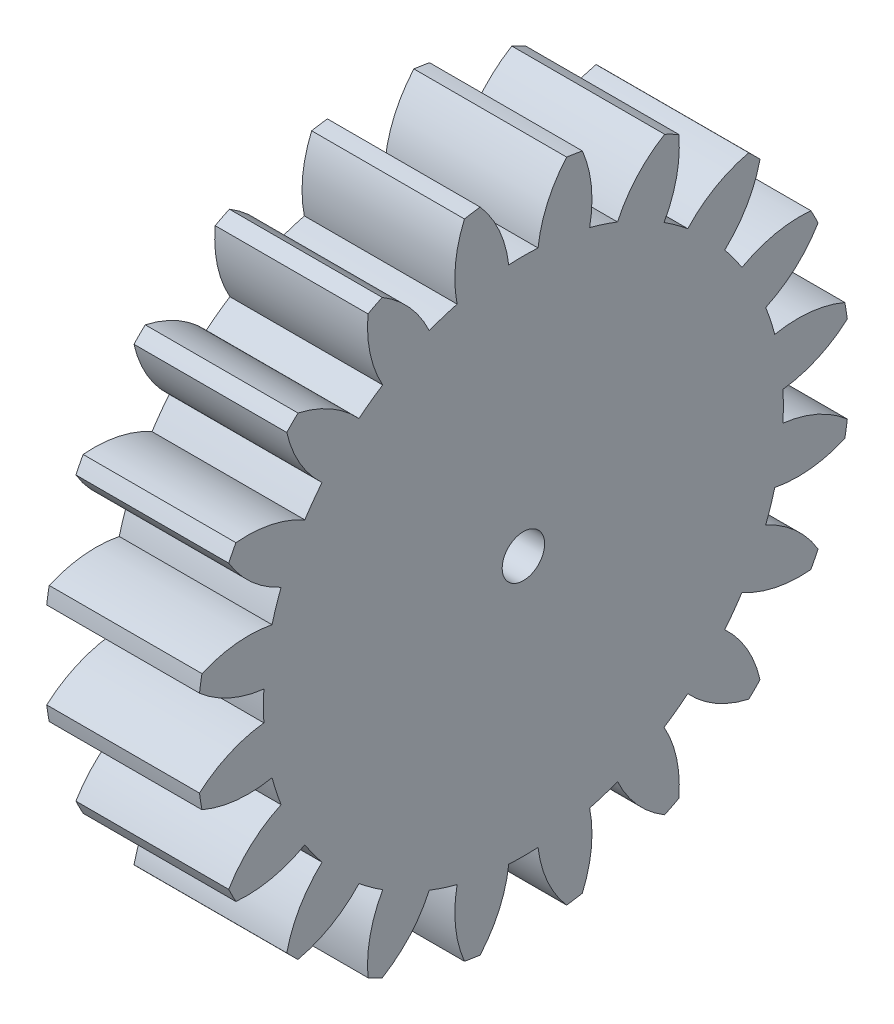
SolidWorks part; units mm, degrees
ref_plane "Plane1" through (0, 0, 0) normal (0, 0, 1) x (1, 0, 0)
ref_plane "Plane2" through (0, 0, 0) normal (0, 1, 0) x (1, 0, 0)
ref_plane "Plane3" through (0, 0, 0) normal (1, 0, 0) x (0, 0, -1)
other "Configuration Table"
sketch "HoldingSke" plane through (0, 0, 0) normal (0, 1, 0) x (1, 0, 0)
  line L0 (0, 0) -> (0.2685, -0.0977)
  line L1 (-15, 0) -> (100, 0) construction
  line L2 (0, 0) -> (-2.1039, 2.3779)
  line L3 (0, 0) -> (-11.863, 4.5341)
  line L4 (0, 0) -> (8.1152, 2.9537)
  line L5 (0, 0) -> (-46.8476, -17.4728)
  line L6 (0, 0) -> (-14.9213, -10.0675)
  line L7 (-2.1039, 2.3779) -> (8.6586, 51.2059)
  line L8 (-76.2, 54.61) -> (-75.3, 54.61)
  line L9 (-71.009, 38.7566) -> (-53.1078, 45.2721)
  line L10 (-76.2, 71.12) -> (104.1128, 71.12)
  line L11 (0, 0) -> (-18, 0)
  line L12 (-76.2, 101.6) -> (-76.083, 101.6)
  line L13 (24.9733, 27.94) -> (52.9518, 28.4284)
  line L14 (24.9733, 27.94) -> (24.9743, 27.94)
  line L15 (24.9733, 27.94) -> (100.4006, 29.5858)
  line L16 (-63.627, -3.5) -> (-12.827, -3.5)
  circle A0 centre (0, 0) radius 2.5
  circle A1 centre (0, 0) radius 30.624
  circle A2 centre (0, 0) radius 37.5
  circle A3 centre (0, 0) radius 2.5
sketch "BasProSke" plane through (0, 0, 0) normal (0, 1, 0) x (1, 0, 0)
  line L0 (-10, 0) -> (60, 0) construction
  line L1 (0, 0) -> (0, 38.5)
  line L2 (0, 0) -> (18, 0)
  line L3 (18, 0) -> (18, 38.5)
  line L4 (18, 38.5) -> (0, 38.5)
revolve "Base-Revolve" add sketch "BasProSke" angle 360 about L0
sketch "TooCutSke" plane through (0, 0, 0) normal (1, 0, 0) x (0, 0, -1)
  line L1 (0, 0) -> (0, 107) construction
  line L2 (0, 0) -> (-2.9507, 34.8754) construction
  line L3 (0, 0) -> (-10.9215, 68.9557) construction
  line L4 (-2.9507, 34.8754) -> (-5.4608, 34.4778) construction
  arc A0 (1.7255, 30.5753) -> (-1.7255, 30.5753) centre (0, 0) ccw
  arc A1 (5.1169, 38.1841) -> (-5.1169, 38.1841) centre (0, 0) ccw
  circle A2 centre (0, 0) radius 35 construction
  circle A3 centre (0, 0) radius 32.8892 construction
  arc A4 (-1.7255, 30.5753) -> (-5.1169, 38.1841) centre (-15.6295, 28.9382) ccw
  arc A5 (5.1169, 38.1841) -> (1.7255, 30.5753) centre (15.6295, 28.9382) ccw
extrude "ToothCut" cut sketch "TooCutSke" along normal through all
fillet "Breaks" [suppressed] radius 0.07
fillet "RootFillets" [suppressed] radius 0.876
pattern_circular "TeethCuts" count 20 every 18 about axis through (-10, 0, 0) along (1, 0, 0) of "ToothCut", "RootFillets", "Breaks"
sketch "HubNeaOneSke" plane through (0, 0, 0) normal (-1, 0, 0) x (0, 0, 1)
  circle A0 centre (0, 0) radius 30.624
extrude "HubNearOne" [suppressed] add sketch "HubNeaOneSke" along normal blind 32.0001
sketch "HubNeaBotSke" plane through (0, 0, 0) normal (-1, 0, 0) x (0, 0, 1)
  circle A0 centre (0, 0) radius 30.624
extrude "HubNearBoth" [suppressed] add sketch "HubNeaBotSke" along normal blind 16
ref_plane "FarPln" through (18, 0, 0) normal (1, 0, 0) x (0, 0, -1)
sketch "HubFarSke" plane through (18, 0, 0) normal (1, 0, 0) x (0, 0, -1)
  circle A0 centre (0, 0) radius 30.624
extrude "HubFar" [suppressed] add sketch "HubFarSke" along normal blind 16
sketch "BorSke" plane through (0, 0, 0) normal (1, 0, 0) x (0, 0, -1)
  circle A0 centre (0, 0) radius 2.5
extrude "Bore" cut sketch "BorSke" along normal mid plane 100.0001
sketch "KeySke" plane through (0, 0, 0) normal (1, 0, 0) x (0, 0, -1)
  line L0 (-1, 0) -> (-1, 3.4)
  line L1 (-1, 3.4) -> (1, 3.4)
  line L2 (1, 3.4) -> (1, 0)
  line L3 (0, 0) -> (0, 34) construction
  line L4 (-1, 0) -> (1, 0)
extrude "Keyway" [suppressed] cut sketch "KeySke" along normal mid plane 100.0001
pattern_circular "Keyway2" [suppressed] count 2 every 90 about axis through (-10, 0, 0) along (1, 0, 0)
equation "' \"Module@HoldingSke\" = 6.35"
equation "' \"Num_teeth@HoldingSke\" = 12"
equation "' \"Ap@HoldingSke\" =  20"
equation "' \"Ap@HoldingSke\" = 20"
equation "' \"Width@HoldingSke\" = 0.5 * 25.4"
equation "' \"Hub_dia@HoldingSke\"= 1 * 25.4"
equation "' \"Hub_dia@HoldingSke\" = 1 * 25.4"
equation "' \"Overall_len@HoldingSke\" = 1.0 * 25.4"
equation "' \"Bore@HoldingSke\" = 0.75 * 25.4"
equation "' \"T_dim@HoldingSke\" = 0.1 * 25.4"
equation "' \"Width@KeySke\" = 0.25 * 25.4"
equation "' \"Show_teeth@HoldingSke\" = 13"
equation "' \"Backlash@HoldingSke\" = 0.009 * 25.4"
equation "' \"Addendum_fac@HoldingSke\" = 1.0"
equation "' \"Dedendum_fac@HoldingSke\" = 1.25"
equation "' \"Dedendum_add@HoldingSke\" = 0.00005 * 25.4"
equation "' \"Clearance_fac@HoldingSke\" = 0.25"
equation "\"Pitch@HoldingSke\" = 1 / \"Module@HoldingSke\""
equation "\"Overcut_dia@TooCutSke\" = (\"Num_teeth@HoldingSke\" + 2 * \"Addendum_fac@HoldingSke\") / \"Pitch@HoldingSke\" + 0.002 * 25.4"
equation "\"Pitch_dia@TooCutSke\" = \"Num_teeth@HoldingSke\" / \"Pitch@HoldingSke\""
equation "\"Base_dia@TooCutSke\" = \"Num_teeth@HoldingSke\" / \"Pitch@HoldingSke\" * cos((\"Ap@HoldingSke\"  * 3.14159265 / 180))"
equation "\"Root_dia@TooCutSke\" = (\"Num_teeth@HoldingSke\" + 2) / \"Pitch@HoldingSke\" - 2 * (\"Addendum_fac@HoldingSke\" + \"Dedendum_fac@HoldingSke\") / \"Pitch@HoldingSke\" - \"Dedendum_add@HoldingSke\" * 2"
equation "\"Half_ang@TooCutSke\" = 180 / \"Num_teeth@HoldingSke\""
equation "\"Half_CT@TooCutSke\" = \"Num_teeth@HoldingSke\" / \"Pitch@HoldingSke\" * sin((3.14159265 / 2 / \"Num_teeth@HoldingSke\")) / 2 - 7 * \"Backlash@HoldingSke\" / 4"
equation "\"Flank_rad@TooCutSke\" = \"Num_teeth@HoldingSke\" / \"Pitch@HoldingSke\" / 5"
equation "\"Radius@RootFillets\" = \"Clearance_fac@HoldingSke\" / \"Pitch@HoldingSke\" + \"Dedendum_add@HoldingSke\""
equation "\"Break_rad@Breaks\" = 0.02 / \"Pitch@HoldingSke\""
equation "\"Thickness@HoldingSke\" = \"Width@HoldingSke\""
equation "\"OAL@HoldingSke\" = \"Thickness@HoldingSke\""
equation "\"MHD@HoldingSke\" = (\"Num_teeth@HoldingSke\" + 2) / \"Pitch@HoldingSke\" - 2 * (\"Addendum_fac@HoldingSke\" + \"Dedendum_fac@HoldingSke\")  / \"Pitch@HoldingSke\" - \"Dedendum_add@HoldingSke\" * 2"
equation "\"MBD@HoldingSke\" = (\"Num_teeth@HoldingSke\" + 2) / \"Pitch@HoldingSke\" - 2 * (\"Addendum_fac@HoldingSke\" + \"Dedendum_fac@HoldingSke\")  / \"Pitch@HoldingSke\" - \"Dedendum_add@HoldingSke\" * 2 - 0.002 * 25.4"
equation "\"MHD@HoldingSke\" = ((sgn( \"MHD@HoldingSke\" - \"Hub_dia@HoldingSke\" )-1)*( \"MHD@HoldingSke\" - \"Hub_dia@HoldingSke\" ))/-2+ \"Hub_dia@HoldingSke\""
equation "\"MBD@HoldingSke\" = ((sgn( \"MBD@HoldingSke\" - \"Bore@HoldingSke\" )-1)*( \"MBD@HoldingSke\" - \"Bore@HoldingSke\" ))/-2+ \"Bore@HoldingSke\""
equation "\"OAL@HoldingSke\" = ((sgn( \"OAL@HoldingSke\" - \"Overall_len@HoldingSke\" )+1)*( \"OAL@HoldingSke\" - \"Overall_len@HoldingSke\" ))/2 + \"Overall_len@HoldingSke\" + 0.000002 * 25.4"
equation "\"Num_teeth@TeethCuts\" = int( \"Show_teeth@HoldingSke\" ) + 1"
equation "\"Num_teeth@TeethCuts\" = ((sgn( \"Num_teeth@TeethCuts\" - \"Num_teeth@HoldingSke\" )-1)*( \"Num_teeth@TeethCuts\" - \"Num_teeth@HoldingSke\" ))/-2+ \"Num_teeth@HoldingSke\""
equation "\"Num_teeth@TeethCuts\" = ((sgn( \"Num_teeth@TeethCuts\" - 2.0)+1)*( \"Num_teeth@TeethCuts\" - 2.0))/2 +2.0"
equation "\"Angle@TeethCuts\" = 360.0 / \"Num_teeth@HoldingSke\""
equation "\"Diameter@BasProSke\" = (\"Num_teeth@HoldingSke\" + 2 * \"Addendum_fac@HoldingSke\") / \"Pitch@HoldingSke\""
equation "\"Thickness@BasProSke\"  = \"Thickness@HoldingSke\""
equation "' \"Fillet_rad@BasProSke\" =  \"Thickness@HoldingSke\" * 0.05"
equation "' \"Fillet_rad@BasProSke\" = \"Thickness@HoldingSke\" * 0.05"
equation "\"MHD@HoldingSke\" = ((sgn( \"MHD@HoldingSke\" - \"Root_dia@TooCutSke\" )-1)*( \"MHD@HoldingSke\" - \"Root_dia@TooCutSke\" ))/-2+ \"Root_dia@TooCutSke\""
equation "\"Diameter@HubNeaOneSke\" = \"MHD@HoldingSke\""
equation "\"Length@HubNearOne\" = \"OAL@HoldingSke\" - \"Thickness@BasProSke\""
equation "\"Diameter@HubNeaBotSke\" = \"MHD@HoldingSke\""
equation "\"Length@HubNearBoth\" = ( \"OAL@HoldingSke\" - \"Thickness@BasProSke\" ) / 2.0"
equation "\"Thickness@FarPln\" = \"Thickness@BasProSke\""
equation "\"Diameter@HubFarSke\" = \"MHD@HoldingSke\""
equation "\"Length@HubFar\" = ( \"OAL@HoldingSke\" - \"Thickness@BasProSke\" ) / 2.0"
equation "\"Diameter@BorSke\" = \"MBD@HoldingSke\""
equation "\"D1@Bore\" = \"OAL@HoldingSke\" * 2.0"
equation "\"D1@Keyway\" = \"OAL@HoldingSke\" * 2.0"
equation "\"Offset@KeySke\" = \"T_dim@HoldingSke\" + \"MBD@HoldingSke\" / 2.0"
